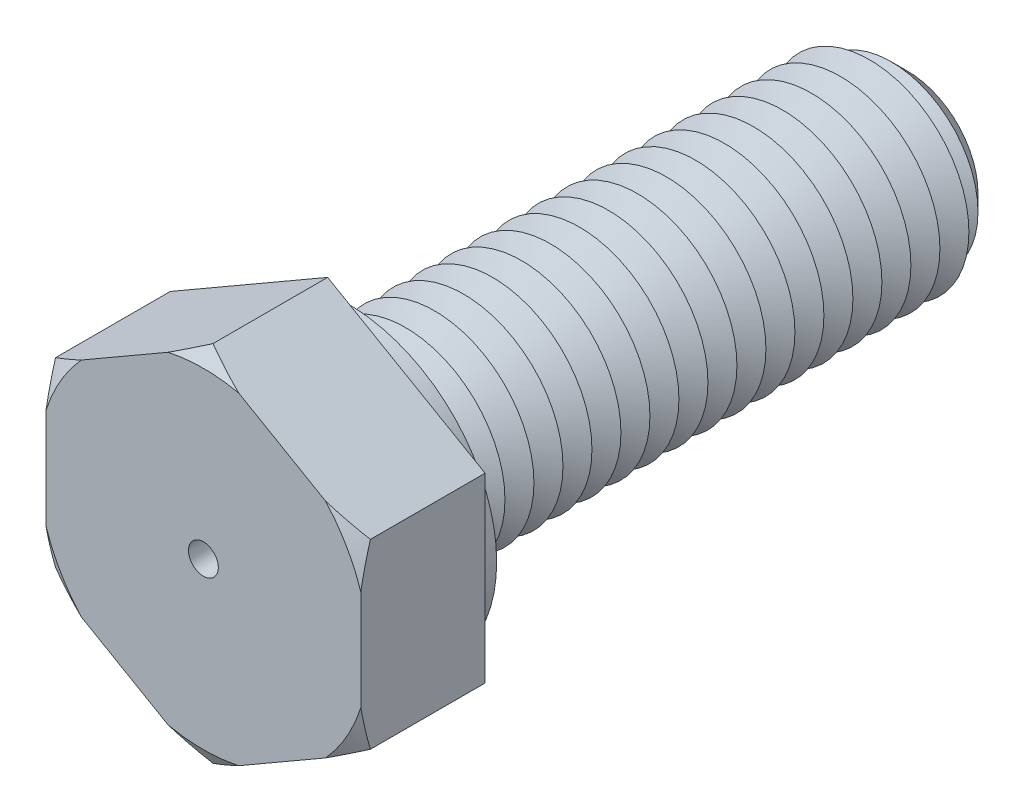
SolidWorks part; units mm, degrees
ref_plane "Front Plane" through (0, 0, 0) normal (0, 0, 1) x (1, 0, 0)
ref_plane "Top Plane" through (0, 0, 0) normal (0, 1, 0) x (1, 0, 0)
ref_plane "Right Plane" through (0, 0, 0) normal (1, 0, 0) x (0, 0, -1)
sketch "Sketch2" plane through (0, 0, 0) normal (0, 0, 1) x (1, 0, 0)
  line L1 (0, 10.9697) -> (-9.5, 5.4848)
  line L2 (-9.5, 5.4848) -> (-9.5, -5.4848)
  line L3 (-9.5, -5.4848) -> (0, -10.9697)
  line L4 (0, -10.9697) -> (9.5, -5.4848)
  line L5 (9.5, -5.4848) -> (9.5, 5.4848)
  line L6 (9.5, 5.4848) -> (0, 10.9697)
  circle A0 centre (0, 0) radius 9.5 construction
  dimension "D1" = 19
extrude "Boss-Extrude1" add sketch "Sketch2" along normal blind 7.5
sketch "Sketch3" plane through (0, 0, 0) normal (0, 0, -1) x (-1, 0, 0)
  circle A0 centre (0, 0) radius 6
  dimension "D1" = 12
extrude "Boss-Extrude2" add sketch "Sketch3" along normal blind 35
sketch "Sketch4" plane through (0, 0, 0) normal (0, 0, -1) x (-1, 0, 0)
  circle A0 centre (0, 0) radius 9
  dimension "D1" = 18
extrude "Boss-Extrude3" add sketch "Sketch4" along normal blind 1.2
sketch "Sketch5" plane through (0, 0, 0) normal (1, 0, 0) x (0, 0, -1)
  line L0 (-3.2117, 0) -> (6.3192, 0) construction
chamfer "Chamfer1" distance 1.75 angle 45 1 edges at (-6, 0, -35)
sketch "Sketch6" plane through (0, 0, 0) normal (1, 0, 0) x (0, 0, -1)
  line L0 (1.2, 6) -> (2.075, 4.4845)
  line L1 (2.075, 4.4845) -> (2.95, 6)
  line L2 (33.25, 6) -> (1.2, 6) construction
  line L3 (2.95, 6) -> (1.2, 6)
  dimension "D1" = 1.75
revolve "Cut-Revolve1" cut sketch "Sketch6" angle 360 about L0
pattern_linear "LPattern1" count 19 spacing 1.75 along (0, 0, -1) of "Cut-Revolve1"
sketch "Sketch7" plane through (0, 0, 0) normal (1, 0, 0) x (0, 0, -1)
  line L0 (-7.5, 10.9697) -> (-7.5, 9.9697)
  line L1 (-7.5, 5.4848) -> (-7.5, 10.9697) construction
  line L2 (-7.5, 9.9697) -> (-6.9226, 10.9697)
  line L3 (-7.5, 10.9697) -> (0, 10.9697) construction
  line L4 (-6.9226, 10.9697) -> (-7.5, 10.9697)
  dimension "D1" = 1
  dimension "D2" = 30
revolve "Cut-Revolve2" cut sketch "Sketch7" angle 360 about L0
sketch "Sketch8" plane through (0, 0, 7.5) normal (0, 0, 1) x (1, 0, 0)
  circle A0 centre (0, 0) radius 0.9
  dimension "D1" = 1.8
extrude "Cut-Extrude1" cut sketch "Sketch8" against normal up to surface (42.5 mm away)
